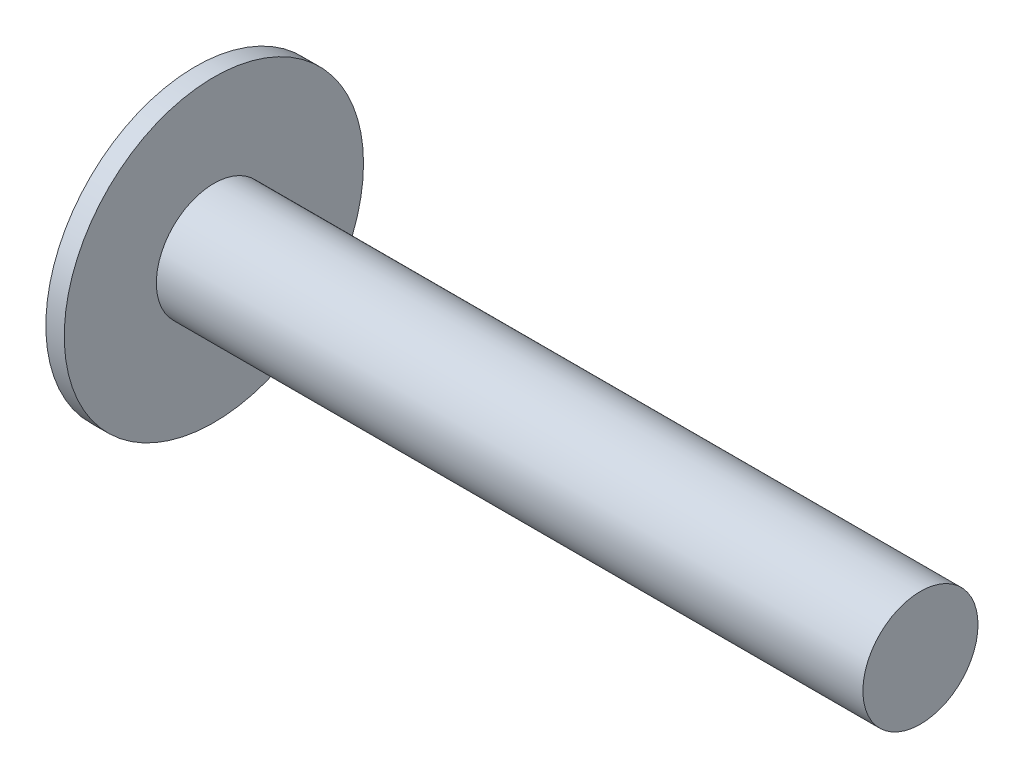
SolidWorks part; units mm, degrees
ref_plane "Front Plane" through (0, 0, 0) normal (0, 0, 1) x (1, 0, 0)
ref_plane "Top Plane" through (0, 0, 0) normal (0, 1, 0) x (1, 0, 0)
ref_plane "Right Plane" through (0, 0, 0) normal (1, 0, 0) x (0, 0, -1)
sketch "Sketch1" plane through (0, 0, 0) normal (0, 1, 0) x (1, 0, 0)
  line L1 (0, 0) -> (-19.49, 0)
  line L2 (0, 0) -> (0, 1.5875)
  line L3 (0, 1.5875) -> (-19.49, 1.5875)
  line L9 (-19.49, -2.54) -> (-19.998, -2.54)
  line L10 (-19.998, -2.54) -> (-19.998, 1.5875)
  line L12 (-19.49, 0) -> (-19.49, -2.54)
  line L13 (-19.49, 1.5875) -> (-19.998, 1.5875)
  dimension "D2" = 1.5875
  dimension "D3" = 2.54
revolve "Revolve1" add sketch "Sketch1" angle 360 about L3
sketch "Sketch2" plane through (-19.998, 0, 0) normal (-1, 0, 0) x (0, 0, 1)
  line L2 (-3.374, 0.3527) -> (0, 0.3527)
  line L3 (0, 0.3527) -> (0, -0.3782)
  line L4 (0, -0.3782) -> (-3.374, -0.3782)
  line L5 (-3.374, -0.3782) -> (-3.374, 0.3527)
extrude "Cut-Extrude1" cut sketch "Sketch2" against normal blind 0.254
